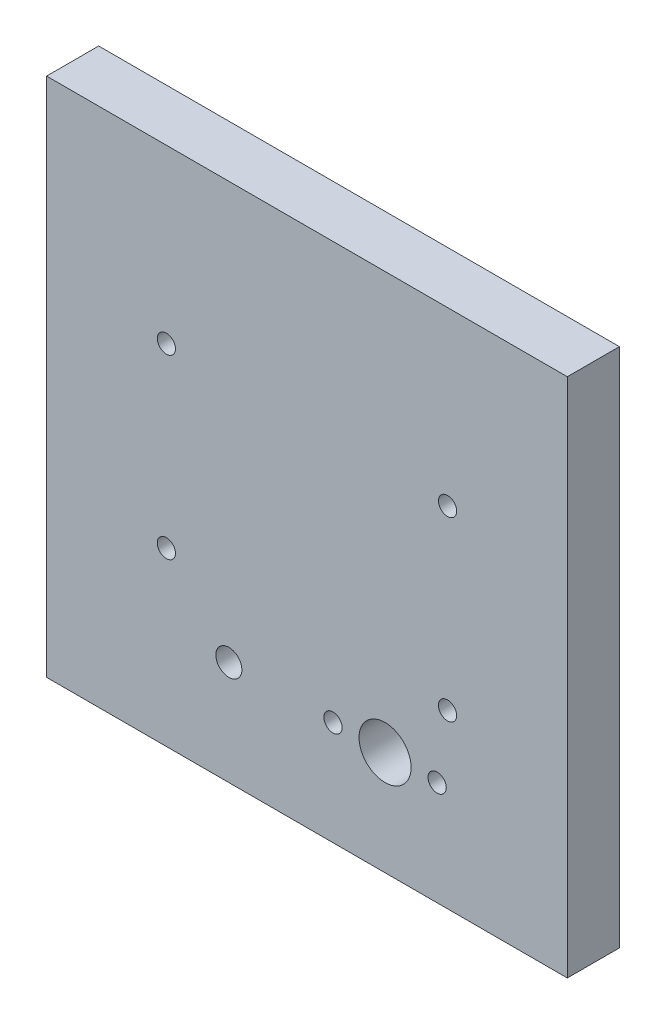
SolidWorks part; units mm, degrees
ref_plane "Спереди" through (0, 0, 0) normal (0, 0, 1) x (1, 0, 0)
ref_plane "Сверху" through (0, 0, 0) normal (0, 1, 0) x (1, 0, 0)
ref_plane "Справа" through (0, 0, 0) normal (1, 0, 0) x (0, 0, -1)
sketch "Эскиз1" plane through (0, 0, 0) normal (0, 0, 1) x (1, 0, 0)
  line L1 (0, 0) -> (100, 0)
  line L2 (0, 0) -> (0, 100)
  line L3 (0, 100) -> (100, 100)
  line L4 (100, 0) -> (100, 100)
extrude "Бобышка-Вытянуть1" add sketch "Эскиз1" along normal blind 10
sketch "Эскиз2" plane through (0, 0, 10) normal (0, 0, 1) x (1, 0, 0)
  line L0 (50, 100) -> (50, 0) construction
  line L1 (100, 100) -> (0, 100) construction
  line L2 (0, 0) -> (100, 0) construction
  line L3 (0, 50) -> (100, 50) construction
  line L4 (0, 100) -> (0, 0) construction
  line L5 (100, 0) -> (100, 100) construction
  line L6 (0, 67) -> (100, 67) construction
  line L7 (100, 33) -> (0, 33) construction
  line L8 (23, 100) -> (23, 0) construction
  line L9 (77, 100) -> (77, 0) construction
  circle A0 centre (23, 67) radius 1.75
  circle A1 centre (77, 67) radius 1.75
  circle A2 centre (23, 33) radius 1.75
  circle A3 centre (77, 33) radius 1.75
  dimension "D1" = 17
  dimension "D2" = 17
  dimension "D3" = 27
  dimension "D4" = 27
extrude "Вырез-Вытянуть1" cut sketch "Эскиз2" against normal blind 8
sketch "Эскиз3" plane through (0, 0, 10) normal (0, 0, 1) x (1, 0, 0)
  line L0 (0, 10) -> (100, 10) construction
  line L1 (0, 100) -> (0, 0) construction
  line L2 (100, 0) -> (100, 100) construction
  line L3 (0, 0) -> (100, 0) construction
  line L4 (50, 100) -> (50, 0) construction
  line L5 (100, 100) -> (0, 100) construction
  line L6 (0, 20) -> (100, 20) construction
  circle A0 centre (35, 20) radius 2.5
  circle A1 centre (65, 20) radius 5
  circle A2 centre (55, 20) radius 1.75
  circle A3 centre (75, 20) radius 1.75
  dimension "D3" = 15
  dimension "D4" = 15
  dimension "D5" = 10
  dimension "D6" = 10
  dimension "D1" = 10
  dimension "D2" = 20
extrude "Вырез-Вытянуть2" cut sketch "Эскиз3" against normal blind 10
